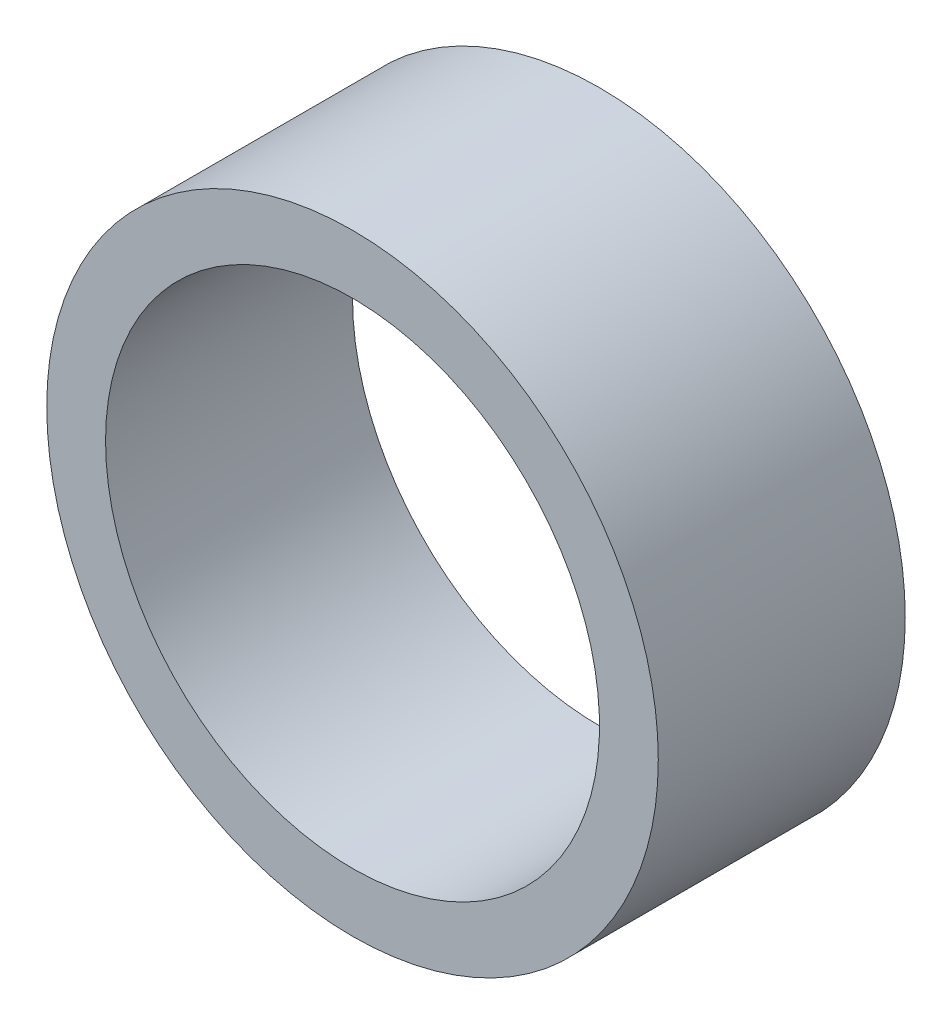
SolidWorks part; units mm, degrees
ref_plane "Спереди" through (0, 0, 0) normal (0, 0, 1) x (1, 0, 0)
ref_plane "Сверху" through (0, 0, 0) normal (0, 1, 0) x (1, 0, 0)
ref_plane "Справа" through (0, 0, 0) normal (1, 0, 0) x (0, 0, -1)
sketch "Sketch1" plane through (0, 0, 0) normal (0, 0, 1) x (1, 0, 0)
  circle A0 centre (0, 0) radius 26
  circle A1 centre (0, 0) radius 21
  dimension "D1" = 52
  dimension "D2" = 5
extrude "Extrude1" add sketch "Sketch1" along normal blind 21
